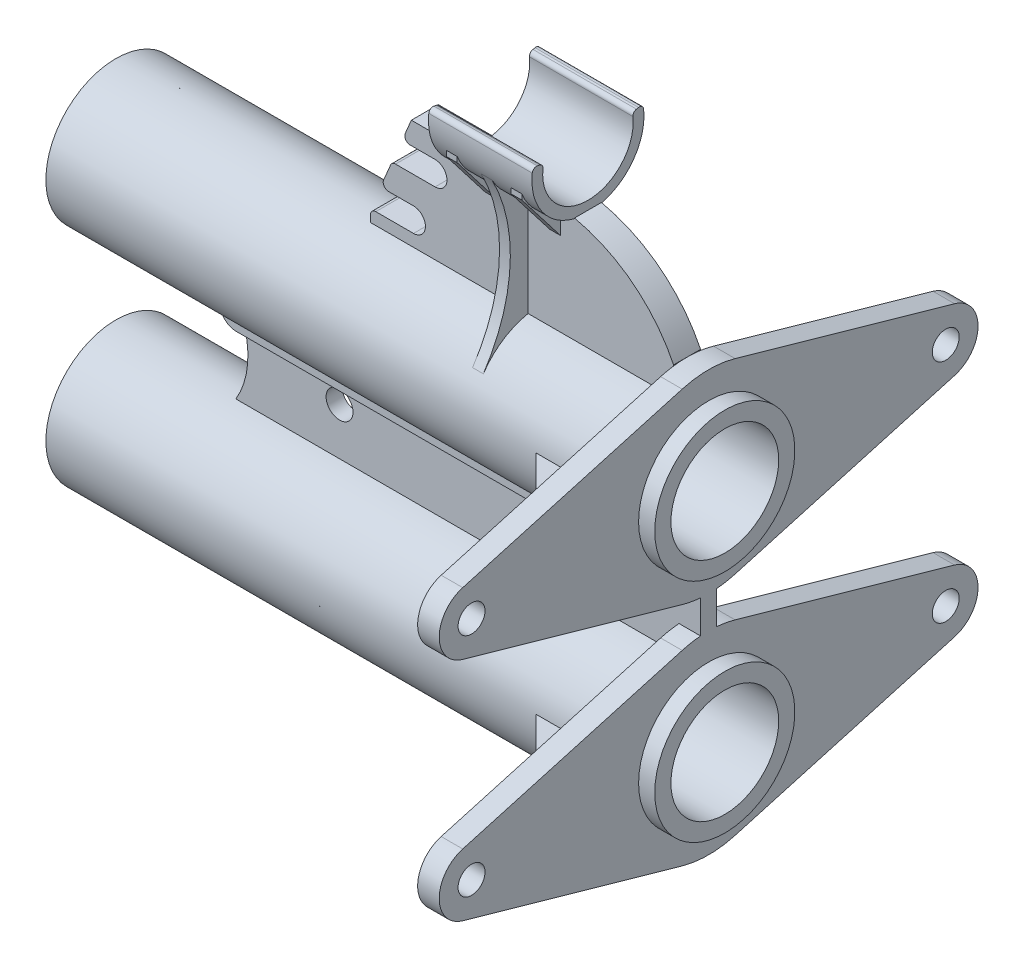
SolidWorks part; units mm, degrees
ref_plane "Front" through (0, 0, 0) normal (0, 0, 1) x (1, 0, 0)
ref_plane "Top" through (0, 0, 0) normal (0, 1, 0) x (1, 0, 0)
ref_plane "Right" through (0, 0, 0) normal (1, 0, 0) x (0, 0, -1)
sketch "Sketch1" plane through (0, 0, 0) normal (1, 0, 0) x (0, 0, -1)
  circle A0 centre (0, 0) radius 8.255
  dimension "D1" = 16.51
extrude "tube" add sketch "Sketch1" against normal blind 69.85
sketch "Sketch2" plane through (0, 0, 0) normal (1, 0, 0) x (0, 0, -1)
  line L0 (27.94, 0) -> (-27.94, 0) construction
  line L1 (-28.9791, 3.6656) -> (-3.1173, 10.9967)
  line L2 (3.1173, 10.9967) -> (28.9791, 3.6656)
  line L3 (28.9791, -3.6656) -> (3.1173, -10.9967)
  line L4 (-28.9791, -3.6656) -> (-3.1173, -10.9967)
  arc A0 (-28.9791, 3.6656) -> (-28.9791, -3.6656) centre (-27.94, 0) ccw
  circle A1 centre (0, 0) radius 11.43
  arc A2 (-3.1173, -10.9967) -> (3.1173, -10.9967) centre (0, 0) ccw
  arc A3 (28.9791, -3.6656) -> (28.9791, 3.6656) centre (27.94, 0) ccw
  arc A4 (3.1173, 10.9967) -> (-3.1173, 10.9967) centre (0, 0) ccw
  circle A5 centre (-27.94, 0) radius 1.5875
  circle A6 centre (27.94, 0) radius 1.5875
  dimension "D2" = 7.62
  dimension "D4" = 3.175
  dimension "D3" = 63.5
  dimension "D1" = 3.175
extrude "flange" add sketch "Sketch2" against normal blind 2.54
sketch "Sketch3" plane through (-69.85, 0, 0) normal (-1, 0, 0) x (0, 0, 1)
  circle A1 centre (0, 0) radius 6.35
  circle A2 centre (0, 0) radius 6.35
  dimension "D1" = 1.905
extrude "hole" cut sketch "Sketch3" against normal through all
sketch "Sketch4" plane through (0, 0, 0) normal (1, 0, 0) x (0, 0, -1)
  circle A0 centre (0, 0) radius 6.35 construction
  circle A1 centre (0, 0) radius 8.255
  circle A2 centre (0, 0) radius 8.255
  circle A3 centre (0, 0) radius 6.35
  dimension "D1" = 1.905
extrude "circular boss" add sketch "Sketch4" along normal blind 1.905
sketch "Sketch6" plane through (0, 0, 0) normal (0, 1, 0) x (1, 0, 0)
  line L0 (-2.54, 7.3025) -> (-13.0175, 7.3025)
  line L1 (-2.54, 7.3025) -> (-2.54, 17.78)
  line L2 (-2.54, 8.255) -> (-69.85, 8.255) construction
  line L4 (-2.54, 3.1173) -> (-2.54, 28.9791) construction
  line L5 (-13.0175, 7.3025) -> (-2.54, 17.78)
  point P7 (-12.065, 8.255)
  dimension "D1" = 0.9525
  dimension "D2" = 9.525
  dimension "D3" = 9.525
extrude "brace" add sketch "Sketch6" along normal mid plane 1.905
mirror "Mirror1" about plane through (0, 0, 0) normal (0, 0, 1) of "brace"
sketch "Sketch5" plane through (0, 0, 0) normal (0, 0, 1) x (1, 0, 0)
  line L0 (0, 7.3025) -> (-55.372, 7.3025)
  line L1 (0, 7.3025) -> (0, 19.3675)
  line L2 (-55.372, 19.3675) -> (0, 19.3675)
  line L3 (-2.54, 8.255) -> (-69.85, 8.255) construction
  line L4 (0, 3.6656) -> (0, 10.9967) construction
  line L5 (-2.54, 8.255) -> (-69.85, 8.255) construction
  line L6 (-63.3105, 18.415) -> (7.5357, 18.415) construction
  arc A0 (-55.372, 7.3025) -> (-55.372, 19.3675) centre (-63.3105, 13.335) ccw
  circle A1 centre (-42.545, 13.7414) radius 1.5875
  circle A2 centre (-12.7, 13.7414) radius 1.5875
  dimension "D6" = 3.175
  dimension "D1" = 0.9525
  dimension "D2" = 53.34
  dimension "D3" = 55.372
  dimension "D4" = 0.9525
  dimension "D5" = 10.16
  dimension "D7" = 12.7
  dimension "D8" = 29.845
  dimension "D9" = 5.4864
extrude "center plate" add sketch "Sketch5" along normal mid plane 1.905
pattern_linear "upper tube&flange" count 2 spacing 26.67 along (0, 1, 0) of "Mirror1", "brace", "tube", "flange", "hole", "circular boss"
sketch "Sketch7" plane through (0, 0, 0) normal (0, 0, 1) x (1, 0, 0)
  line L0 (-33.4455, 47.625) -> (-17.78, 47.625)
  line L1 (-2.54, 34.925) -> (-69.85, 34.925) construction
  line L2 (-2.54, 30.3356) -> (-2.54, 37.6667) construction
  line L3 (-2.54, 33.9725) -> (-2.54, 38.1)
  line L4 (-38.2715, 33.9725) -> (-38.2715, 36.195)
  line L5 (0, 38.1) -> (-2.54, 38.1) construction
  line L6 (-2.54, 33.9725) -> (-69.85, 33.9725)
  line L7 (-2.54, 33.9725) -> (-38.2715, 33.9725)
  line L9 (-38.2715, 36.195) -> (-33.1915, 36.195)
  line L11 (-33.1915, 39.0029) -> (-37.086, 39.0029)
  line L12 (-35.7315, 42.2108) -> (-30.6515, 42.2108)
  line L14 (-30.6515, 45.0187) -> (-34.546, 45.0187)
  line L15 (-34.546, 45.0187) -> (-33.4455, 47.625)
  line L16 (-35.7315, 42.2108) -> (-37.086, 39.0029)
  arc A0 (-2.54, 38.1) -> (-17.78, 47.625) centre (-17.78, 30.6705) ccw
  arc A1 (-33.1915, 39.0029) -> (-33.1915, 36.195) centre (-33.1915, 37.5989) cw
  arc A2 (-30.6515, 42.2108) -> (-30.6515, 45.0187) centre (-30.6515, 43.6147) ccw
  dimension "D3" = 5.08
  dimension "D1" = 12.7
  dimension "D2" = 15.24
  dimension "D5" = 7.62
  dimension "D6" = 1.27
  dimension "D7" = 30.9055
  dimension "D8" = 35.7315
  dimension "D9" = 2.6063
  dimension "D4" = 0.9525
extrude "sight" add sketch "Sketch7" along normal mid plane 3.175
fillet "R025" radius 0.635 4 edges at (-34.546, 45.0187, 0) (-35.7315, 42.2108, 0) (-37.086, 39.0029, 0) (-38.2715, 36.195, 0)
ref_plane "centersupport" through (-20.32, 0, 0) normal (1, 0, 0) x (0, 0, -1)
sketch "Sketch8" plane through (-20.32, 0, 0) normal (1, 0, 0) x (0, 0, -1)
  line L0 (-10.4652, 54.864) -> (5.9346, 54.864) construction
  line L1 (-1.5875, 47.625) -> (1.5875, 47.625) construction
  arc A0 (-6.4807, 54.864) -> (6.4807, 54.864) centre (0, 53.594) ccw
  dimension "D1" = 13.208
  dimension "D2" = 1.27
  dimension "D3" = 0.635
extrude "ammo holder" add sketch "Sketch8" along normal mid plane 12.192 thin
fillet "R020" radius 0.508 4 edges at (-20.32, 54.6198, 5.2344) (-20.32, 54.864, 6.4807) (-20.32, 54.864, -6.4807) (-20.32, 54.6198, -5.2344)
sketch "Sketch9" plane through (-20.32, 0, 0) normal (1, 0, 0) x (0, 0, -1)
  line L0 (1.5875, 38.1) -> (1.5875, 47.2479) construction
  line L1 (0, 50) -> (0, -50) construction
  line L3 (1.5875, 34.7709) -> (1.5875, 47.1836)
  arc A0 (6.8644, 31.2553) -> (1.5875, 34.7709) centre (0, 26.67) ccw
  arc A1 (5.8472, 50.5244) -> (6.8644, 31.2553) centre (22.5693, 41.7457) ccw
  arc A2 (1.5875, 47.1836) -> (6.564, 54.3195) centre (0, 53.594) ccw construction
  circle A3 centre (0, 26.67) radius 8.255 construction
  arc A4 (1.5875, 47.1836) -> (5.8472, 50.5244) centre (0, 53.594) ccw
  dimension "D1" = 3.683
extrude "support" add sketch "Sketch9" against normal mid plane 1.27
ref_plane "brace plane" through (-23.495, 0, 0) normal (-1, 0, 0) x (0, 0, 1)
sketch "Sketch10" plane through (-23.495, 0, 0) normal (-1, 0, 0) x (0, 0, 1)
  line L0 (-1.5875, 44.6436) -> (-6.1428, 50.5345)
  line L2 (-6.1428, 50.5345) -> (-6.1428, 51.1695)
  line L3 (-1.5875, 34.7709) -> (-1.5875, 47.1836) construction
  line L4 (-1.5875, 44.6436) -> (-1.5875, 47.1836)
  line L5 (-1.5875, 47.2479) -> (-1.5875, 38.1) construction
  arc A0 (-6.1428, 51.1695) -> (-1.5875, 47.1836) centre (0, 53.594) ccw
  arc A1 (-6.564, 54.3195) -> (-1.5875, 47.1836) centre (0, 53.594) ccw construction
  arc A2 (-6.6903, 54.3335) -> (-1.618, 47.0604) centre (0, 53.594) ccw
  arc A3 (-6.6903, 54.3335) -> (-0.1539, 46.8648) centre (0, 53.594) ccw construction
  dimension "D1" = 2.54
  dimension "D3" = 0.635
  dimension "D2" = 0.127
extrude "support brace" add sketch "Sketch10" along normal blind 1.27
mirror "Mirror2" about plane through (-20.32, 0, 0) normal (1, 0, 0) of "support brace"
sketch "Sketch11" plane through (-2.54, 0, 0) normal (-1, 0, 0) x (0, 0, 1)
  line L0 (-0.9525, 15.2798) -> (-0.9525, 18.4701) construction
  line L1 (-0.9525, 17.0203) -> (-0.9525, 18.4701)
  line L4 (-2.8575, 17.0203) -> (-0.9525, 17.0203)
  line L5 (-2.8575, 17.0203) -> (-2.8575, 18.9253)
  arc A0 (-8.1999, 25.7175) -> (-0.9525, 18.4701) centre (0, 26.67) ccw construction
  arc A1 (-2.8575, 18.9253) -> (-0.9525, 18.4701) centre (0, 26.67) ccw
  dimension "D1" = 1.905
  dimension "D2" = 1.905
extrude "rail" add sketch "Sketch11" along normal up to surface (51.5061 mm away)
fillet "R075" radius 1.905 1 edges at (-28.293, 17.0203, -2.8575)
mirror "Mirror3" about plane through (0, 0, 0) normal (0, 0, 1) of "R075", "rail", "support", "support brace", "Mirror2"
